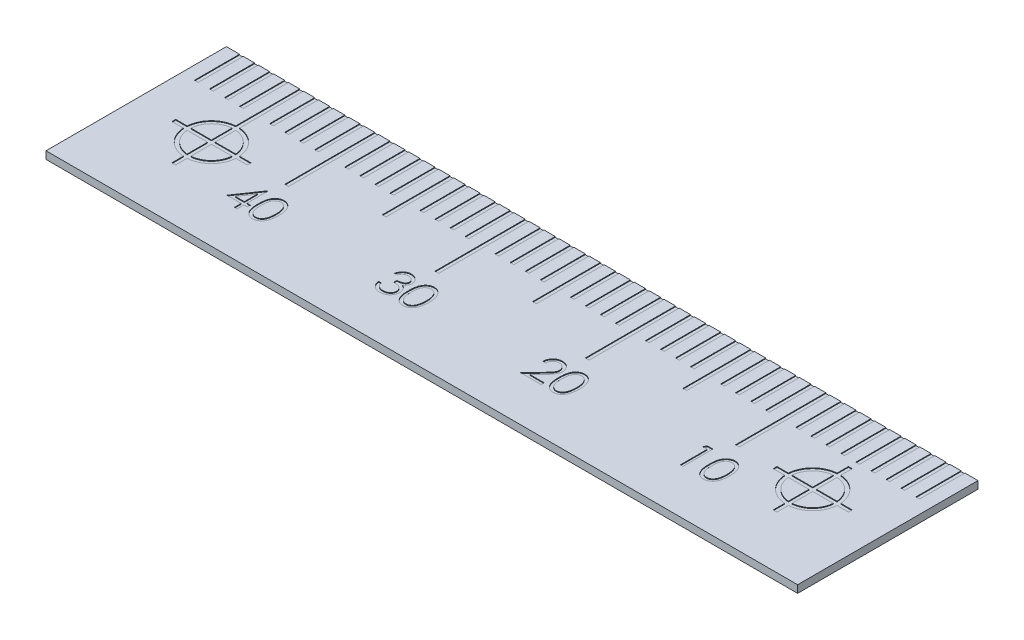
SolidWorks part; units mm, degrees
ref_plane "Front Plane" through (0, 0, 0) normal (0, 0, 1) x (1, 0, 0)
ref_plane "Top Plane" through (0, 0, 0) normal (0, 1, 0) x (1, 0, 0)
ref_plane "Right Plane" through (0, 0, 0) normal (1, 0, 0) x (0, 0, -1)
sketch "Sketch1" plane through (0, 0, 0) normal (0, 1, 0) x (1, 0, 0)
  line L1 (-25, 6) -> (25, 6)
  line L2 (-25, 6) -> (-25, -6)
  line L3 (-25, -6) -> (25, -6)
  line L4 (25, 6) -> (25, -6)
extrude "Boss-Extrude1" add sketch "Sketch1" against normal blind 0.5
sketch "Sketch2" plane through (0, 0, 0) normal (0, 1, 0) x (1, 0, 0)
  line L1 (-24.125, 3) -> (-23.875, 3)
  line L2 (-24.125, 3) -> (-24.125, 6)
  line L3 (-24.125, 6) -> (-23.875, 6)
  line L4 (-23.875, 3) -> (-23.875, 6)
  line L5 (-24, 6) -> (-24, 3) construction
  line L6 (-25, 6) -> (-25, -6) construction
  dimension "D1" = 3
  dimension "D2" = 0.25
  dimension "D3" = 1
extrude "Cut-Extrude2" cut sketch "Sketch2" against normal blind 0.05 contours L4 L3 L2 L1
pattern_linear "LPattern2" count 49 spacing 1 along (1, 0, 0) of "Cut-Extrude2"
sketch "Sketch3" plane through (0, 0, 0) normal (0, 1, 0) x (1, 0, 0)
  line L0 (-15.125, 3) -> (-15.125, 6) construction
  line L6 (-15.125, 3) -> (-14.875, 3)
  line L7 (-15.125, 3) -> (-15.125, 0)
  line L8 (-15.125, 0) -> (-14.875, 0)
  line L9 (-14.875, 3) -> (-14.875, 0)
  dimension "D1" = 0
  dimension "D2" = 0.25
  dimension "D4" = 3
extrude "Cut-Extrude3" cut sketch "Sketch3" against normal blind 0.05
pattern_linear "LPattern3" count 4 spacing 10 along (1, 0, 0) of "Cut-Extrude3"
sketch "Sketch4" plane through (0, 0, 0) normal (0, 1, 0) x (1, 0, 0)
  line L0 (-10.125, 3) -> (-10.125, 6) construction
  line L1 (-10.125, 3) -> (-9.875, 3)
  line L2 (-10.125, 3) -> (-10.125, 1.5)
  line L3 (-10.125, 1.5) -> (-9.875, 1.5)
  line L4 (-9.875, 3) -> (-9.875, 1.5)
  dimension "D1" = 0
  dimension "D2" = 0.25
  dimension "D3" = 3
  dimension "D4" = 1.5
extrude "Cut-Extrude4" cut sketch "Sketch4" against normal blind 0.05
pattern_linear "LPattern4" count 3 spacing 10 along (1, 0, 0) count 2 spacing 10 along (-1, 0, 0) of "Cut-Extrude4"
sketch "Sketch5" plane through (0, 0, 0) normal (0, 1, 0) x (1, 0, 0)
  line L0 (-19.995, 0) -> (-19.995, 2.5) construction
  line L1 (-19.995, 0) -> (-19.995, -2.5) construction
  line L2 (-19.995, 0) -> (-17.495, 0) construction
  line L3 (-19.995, 0) -> (-22.495, 0) construction
  line L5 (-20.12, 2.5) -> (-19.87, 2.5)
  line L6 (-20.12, 2.5) -> (-20.12, 1.7455)
  line L7 (-20.12, -2.5) -> (-19.87, -2.5)
  line L8 (-19.87, 2.5) -> (-19.87, 1.7455)
  line L9 (-22.495, 0.125) -> (-21.7405, 0.125)
  line L10 (-22.495, 0.125) -> (-22.495, -0.125)
  line L11 (-22.495, -0.125) -> (-21.7405, -0.125)
  line L12 (-17.495, 0.125) -> (-17.495, -0.125)
  line L13 (-23.125, 6) -> (-23.875, 6) construction
  line L14 (-20.12, 1.4948) -> (-20.12, 0.125)
  line L15 (-19.87, 1.4948) -> (-19.87, 0.125)
  line L16 (-18.2495, 0.125) -> (-17.495, 0.125)
  line L17 (-18.2495, -0.125) -> (-17.495, -0.125)
  line L18 (-19.87, -1.7455) -> (-19.87, -2.5)
  line L19 (-20.12, -1.7455) -> (-20.12, -2.5)
  line L20 (-21.4898, -0.125) -> (-20.12, -0.125)
  line L21 (-21.4898, 0.125) -> (-20.12, 0.125)
  line L22 (-19.87, -0.125) -> (-19.87, -1.4948)
  line L23 (-19.87, 0.125) -> (-18.5002, 0.125)
  line L24 (-20.12, -0.125) -> (-20.12, -1.4948)
  line L25 (-19.87, -0.125) -> (-18.5002, -0.125)
  arc A0 (-20.12, 1.4948) -> (-21.4898, 0.125) centre (-19.995, 0) ccw
  arc A1 (-20.12, 1.7455) -> (-21.7405, 0.125) centre (-19.995, 0) ccw
  arc A2 (-18.5002, 0.125) -> (-19.87, 1.4948) centre (-19.995, 0) ccw
  arc A3 (-18.2495, 0.125) -> (-19.87, 1.7455) centre (-19.995, 0) ccw
  arc A4 (-19.87, -1.4948) -> (-18.5002, -0.125) centre (-19.995, 0) ccw
  arc A5 (-19.87, -1.7455) -> (-18.2495, -0.125) centre (-19.995, 0) ccw
  arc A6 (-21.4898, -0.125) -> (-20.12, -1.4948) centre (-19.995, 0) ccw
  arc A7 (-21.7405, -0.125) -> (-20.12, -1.7455) centre (-19.995, 0) ccw
  point P34 (-19.995, 2.5)
extrude "Cut-Extrude6" cut sketch "Sketch5" against normal blind 0.05
pattern_linear "LPattern5" count 2 spacing 40 along (1, 0, 0) of "Cut-Extrude6"
sketch "Sketch7" plane through (0, 0, 0) normal (0, 1, 0) x (1, 0, 0)
  line L0 (-25, -6) -> (25, -6) construction
  line L1 (-25, 6) -> (-25, -6) construction
  text T0 "10         20         30         40" font "Century Gothic" height 2
  dimension "D1" = 3
  dimension "D2" = 8.5
extrude "Cut-Extrude7" [suppressed] cut sketch "Sketch7" against normal blind 0.05
sketch "Sketch11" plane through (0, 0, 0) normal (0, 1, 0) x (1, 0, 0)
  line L0 (-25, -6) -> (25, -6) construction
  line L1 (-25, 6) -> (-25, -6) construction
  text T0 "50         60         70         80         90" font "Century Gothic" height 2
  dimension "D1" = 3
  dimension "D2" = 48.5
extrude "Cut-Extrude8" [suppressed] cut sketch "Sketch11" against normal blind 0.05
sketch "Sketch14" plane through (0, 0, 0) normal (0, 1, 0) x (1, 0, 0)
  line L0 (-25, -6) -> (25, -6) construction
  line L1 (-25, 6) -> (-25, -6) construction
  text T0 "100       110       120       130       140" font "Century Gothic" height 2
  dimension "D1" = 3
  dimension "D2" = 97.5
extrude "Cut-Extrude10" [suppressed] cut sketch "Sketch14" against normal blind 0.05
sketch "Sketch15" plane through (0, 0, 0) normal (0, 1, 0) x (1, 0, 0)
  line L0 (-25, 6) -> (-25, -6) construction
  line L1 (-25, -6) -> (25, -6) construction
  text T0 "40         30         20         10" font "Century Gothic" height 2
  dimension "D1" = 8.5
  dimension "D2" = 3
extrude "Cut-Extrude12" cut sketch "Sketch15" against normal blind 0.05
sketch "Sketch18" plane through (0, 0, 0) normal (0, 1, 0) x (1, 0, 0)
  line L0 (-25, -6) -> (25, -6) construction
  line L1 (-25, 6) -> (-25, -6) construction
  text T0 "90         80         70         60         50" font "Century Gothic" height 2
  dimension "D1" = 3
  dimension "D2" = 8.5
extrude "Cut-Extrude13" [suppressed] cut sketch "Sketch18" against normal blind 0.05
sketch "Sketch19" plane through (0, 0, 0) normal (0, 1, 0) x (1, 0, 0)
  line L0 (-25, 6) -> (-25, -6) construction
  line L1 (-25, -6) -> (25, -6) construction
  text T0 "140       130       120       110       100" font "Century Gothic" height 2
  dimension "D1" = 7.5
  dimension "D2" = 3
extrude "Cut-Extrude14" [suppressed] cut sketch "Sketch19" against normal blind 0.05
sketch "Sketch20" plane through (0, 0, 0) normal (0, 1, 0) x (1, 0, 0)
  circle A0 centre (-19.995, 0) radius 1.75
extrude "Cut-Extrude15" [suppressed] cut sketch "Sketch20" against normal blind 0.5
pattern_linear "LPattern6" [suppressed] count 2 spacing 40
sketch "Sketch21" plane through (0, 0, 0) normal (0, 1, 0) x (1, 0, 0)
  line L0 (-25, -6) -> (25, -6) construction
  line L1 (-25, 6) -> (-25, -6) construction
  text T0 "10         20         30         40         50         40         30         20         10" font "Century Gothic" height 2
  dimension "D1" = 3
  dimension "D2" = 8.5
extrude "Cut-Extrude17" [suppressed] cut sketch "Sketch21" against normal blind 0.05
sketch "Sketch22" plane through (0, 0, 0) normal (0, 1, 0) x (1, 0, 0)
  line L0 (-25, -6) -> (25, -6) construction
  line L1 (-25, 6) -> (-25, -6) construction
  text T0 "10         20         30         40         50         60         70         80         90        100        90         80         70         60         50         40         30         20         10" font "Century Gothic" height 2
  dimension "D1" = 3
  dimension "D2" = 8.5
extrude "Cut-Extrude18" [suppressed] cut sketch "Sketch22" against normal blind 0.05
sketch "Sketch23" plane through (0, 0, 0) normal (0, 1, 0) x (1, 0, 0)
  line L0 (-25, -6) -> (25, -6) construction
  line L2 (-25, 6) -> (-25, -6) construction
  text T0 "10         20         30         40         50         60         70         80         90        100       110       120       130       140       150       160       170       180       190       20" font "Century Gothic" height 2
  dimension "D1" = 3
  dimension "D2" = 8.5
extrude "Cut-Extrude19" [suppressed] cut sketch "Sketch23" against normal blind 0.05
sketch "Sketch24" plane through (0, 0, 0) normal (0, 1, 0) x (1, 0, 0)
  line L0 (-25, -6) -> (25, -6) construction
  line L1 (-25, 6) -> (-25, -6) construction
  text T0 "10         20         30         40         50         60         70         80         90        100       110       120       130       140       150       160       170       180       190" font "Century Gothic" height 2
  dimension "D1" = 3
  dimension "D2" = 8.5
extrude "Cut-Extrude20" [suppressed] cut sketch "Sketch24" against normal blind 0.05
sketch "Sketch26" plane through (0, 0, 0) normal (0, 1, 0) x (1, 0, 0)
  line L0 (-25, -6) -> (25, -6) construction
  line L1 (-25, 6) -> (-25, -6) construction
  text T0 "190       180       170       160       150       140       130       120       110       100        90         80         70         60         50         40         30         20         10" font "Century Gothic" height 2
  dimension "D1" = 3
  dimension "D2" = 7.5
extrude "Cut-Extrude21" [suppressed] cut sketch "Sketch26" against normal blind 0.05
sketch "Sketch27" plane through (0, 0, 0) normal (0, 1, 0) x (1, 0, 0)
  line L0 (-25, -6) -> (25, -6) construction
  line L1 (-25, 6) -> (-25, -6) construction
  text T0 "490       480       470       460       450       440       430       420       410       400       390       380       370       360       350       340       330       320       310       300       " font "Century Gothic" height 2
  dimension "D1" = 3
  dimension "D2" = 7.5
extrude "Cut-Extrude22" [suppressed] cut sketch "Sketch27" against normal blind 0.05
sketch "Sketch29" plane through (0, 0, 0) normal (0, 1, 0) x (1, 0, 0)
  line L0 (-25, -6) -> (25, -6) construction
  line L1 (-25, 6) -> (-25, -6) construction
  text T0 "10         20         30         40         50         60         70         80         90        100       110       120       130       140       150       160       170       180       190       20" font "Century Gothic" height 2
  dimension "D1" = 3
  dimension "D2" = 8.5
extrude "Cut-Extrude23" [suppressed] cut sketch "Sketch29" against normal blind 0.05
sketch "Sketch30" plane through (0, 0, 0) normal (0, 1, 0) x (1, 0, 0)
  line L0 (-25, -6) -> (25, -6) construction
  line L1 (-25, 6) -> (-25, -6) construction
  text T0 "240       230       220       210       200       190       180       170       160       150       140       130       120       110       100        90         80         70         60         50   " font "Century Gothic" height 2
  dimension "D1" = 3
  dimension "D2" = 7.5
extrude "Cut-Extrude24" [suppressed] cut sketch "Sketch30" against normal blind 0.05
sketch "Sketch31" [suppressed] plane through (0, 0, 0) normal (0, 1, 0) x (1, 0, 0)
  line L0 (-100, -6) -> (100, -6) construction
  line L1 (-100, 6) -> (-100, -6) construction
  text T0 "150       160       170       180       190" font "Century Gothic" height 2
  dimension "D1" = 3
  dimension "D2" = 148.5
extrude "Cut-Extrude25" [suppressed] cut sketch "Sketch31" against normal blind 0.05
sketch "Sketch32" [suppressed] plane through (0, 0, 0) normal (0, 1, 0) x (1, 0, 0)
  line L0 (-25, -6) -> (25, -6) construction
  line L1 (-24.125, -6) -> (-23.875, -6)
  line L2 (-24.125, -6) -> (-24.125, -3)
  line L3 (-24.125, -3) -> (-23.875, -3)
  line L4 (-23.875, -6) -> (-23.875, -3)
  line L5 (-24, -3) -> (-24, -6) construction
  line L6 (-25, 6) -> (-25, -6) construction
  dimension "D1" = 0.25
  dimension "D2" = 3
  dimension "D3" = 1
extrude "Cut-Extrude26" [suppressed] cut sketch "Sketch32" against normal blind 0.05
pattern_linear "LPattern7" [suppressed] count 99 spacing 1
sketch "Sketch34" [suppressed] plane through (0, 0, 0) normal (0, 1, 0) x (1, 0, 0)
  line L1 (-245.125, -3) -> (-244.875, -3)
  line L2 (-245.125, -3) -> (-245.125, -1.5)
  line L3 (-245.125, -1.5) -> (-244.875, -1.5)
  line L4 (-244.875, -3) -> (-244.875, -1.5)
  dimension "D1" = 1.5
  dimension "D2" = 0.25
extrude "Cut-Extrude27" [suppressed] cut sketch "Sketch34" against normal blind 0.05
pattern_linear "LPattern8" [suppressed] count 4 spacing 10
sketch "Sketch35" [suppressed] plane through (0, 0, 0) normal (0, 1, 0) x (1, 0, 0)
  line L1 (-240.125, -3) -> (-239.875, -3)
  line L2 (-240.125, -3) -> (-240.125, 0)
  line L3 (-240.125, 0) -> (-239.875, 0)
  line L4 (-239.875, -3) -> (-239.875, 0)
  dimension "D1" = 3
  dimension "D2" = 0.25
extrude "Cut-Extrude28" [suppressed] cut sketch "Sketch35" against normal blind 0.05
pattern_linear "LPattern9" [suppressed] count 4 spacing 10
equation "\"D2@Sketch1\"=\"D1@Sketch1\"/2"
equation "\"D4@Sketch1\"=\"D3@Sketch1\"/2"
equation "\"D8@Sketch5\"=\"D7@Sketch5\"/2"
equation "\"D10@Sketch5\"=\"D9@Sketch5\"/2"
